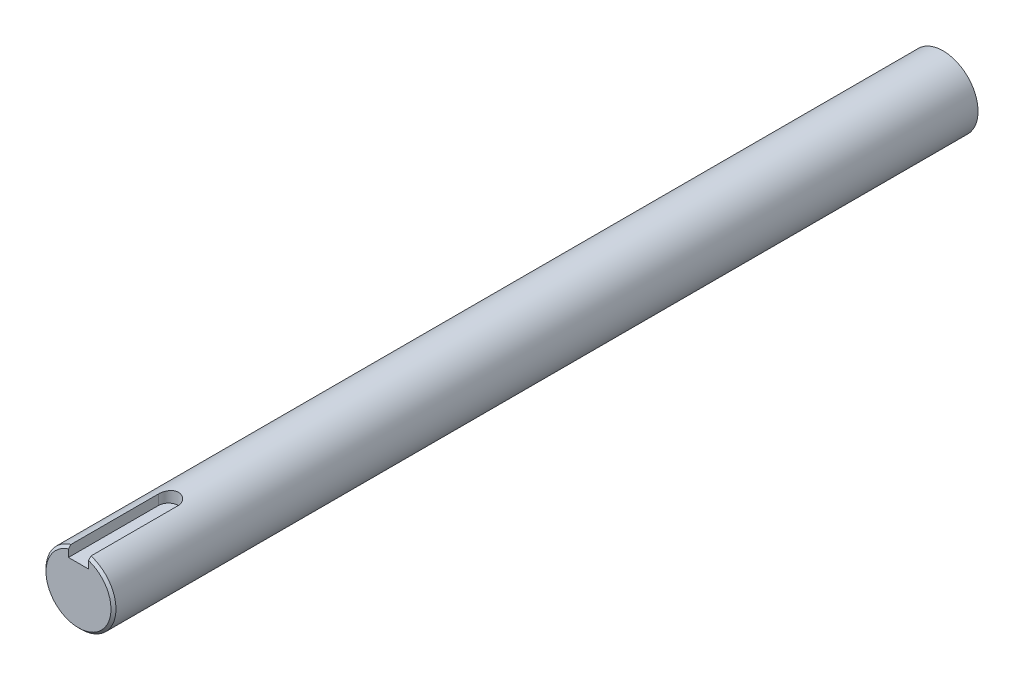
SolidWorks part; units mm, degrees
ref_plane "前视基准面" through (0, 0, 0) normal (0, 0, 1) x (1, 0, 0)
ref_plane "上视基准面" through (0, 0, 0) normal (0, 1, 0) x (1, 0, 0)
ref_plane "右视基准面" through (0, 0, 0) normal (1, 0, 0) x (0, 0, -1)
sketch "草图1" plane through (0, 0, 0) normal (0, 0, 1) x (1, 0, 0)
  line L0 (2, 4.7) -> (-2, 4.7)
  line L1 (0, 11.0283) -> (0, -13.3285) construction
  line L3 (2, 4.7) -> (2, 6.7082)
  line L4 (-2, 4.7) -> (-2, 6.7082)
  arc A0 (-2, 6.7082) -> (2, 6.7082) centre (0, 0) ccw
  dimension "D1" = 14
  dimension "D2" = 4.7
extrude "凸台-拉伸1" add sketch "草图1" along normal blind 98
sketch "草图2" plane through (0, 0, 0) normal (0, 0, -1) x (-1, 0, 0)
  circle A0 centre (0, 0) radius 7
  dimension "D1" = 14
extrude "凸台-拉伸4" add sketch "草图2" against normal blind 80
sketch "草图6" plane through (0, 4.7, 0) normal (0, 1, 0) x (1, 0, 0)
  line L0 (-2, -80) -> (-2, -98) construction
  line L1 (-2, -80) -> (2, -80)
  arc A0 (2, -80) -> (-2, -80) centre (0, -80) ccw
extrude "切除-拉伸20" cut sketch "草图6" along normal blind 80
chamfer "倒角1" distance 0.5 angle 45 1 edges at (0, -7, 98)
sketch "草图7" plane through (0, 0, 0) normal (0, 0, -1) x (-1, 0, 0)
  circle A1 centre (0, 0) radius 7
  circle A2 centre (0, 0) radius 7
  dimension "D1" = 0
extrude "凸台-拉伸5" add sketch "草图7" along normal blind 75
